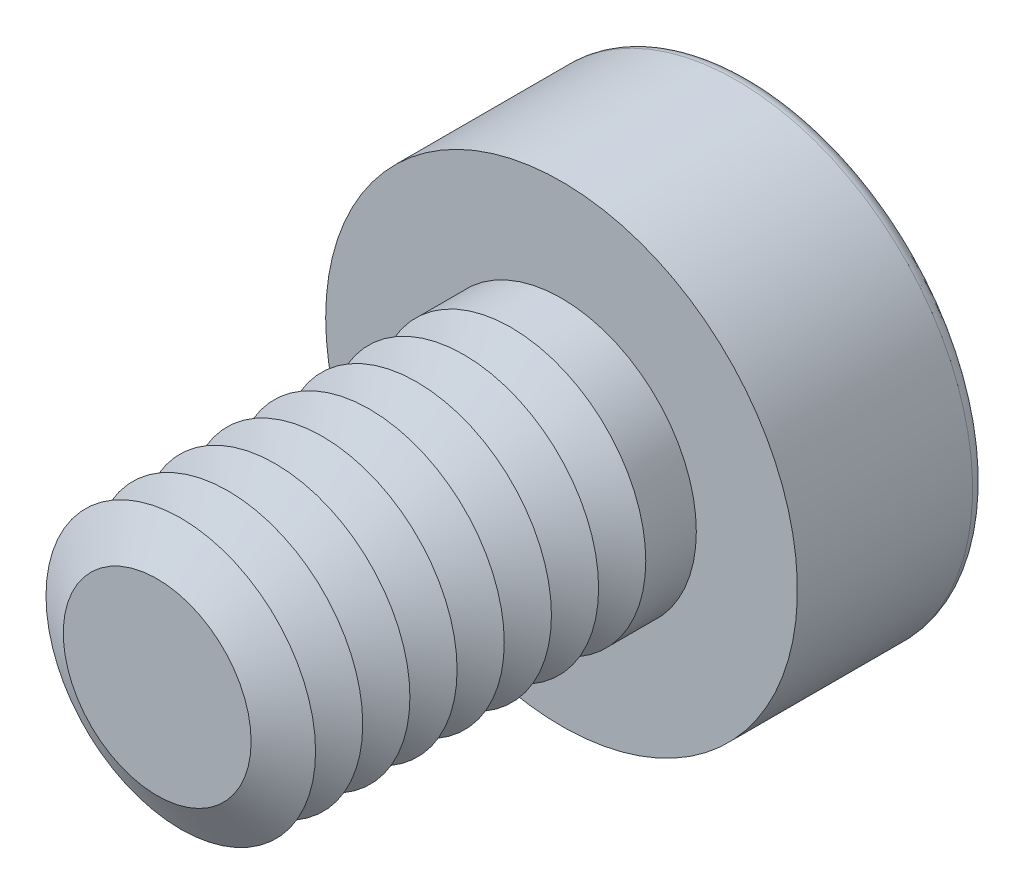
SolidWorks part; units mm, degrees
ref_plane "Front Plane" through (0, 0, 0) normal (0, 0, 1) x (1, 0, 0)
ref_plane "Top Plane" through (0, 0, 0) normal (0, 1, 0) x (1, 0, 0)
ref_plane "Right Plane" through (0, 0, 0) normal (1, 0, 0) x (0, 0, -1)
sketch "Sketch1" plane through (0, 0, 0) normal (0, 0, 1) x (1, 0, 0)
  circle A0 centre (0, 0) radius 2
  dimension "D1" = 4
extrude "Boss-Extrude1" add sketch "Sketch1" along normal blind 6
sketch "Sketch2" plane through (0, 0, 0) normal (0, 0, -1) x (-1, 0, 0)
  circle A0 centre (0, 0) radius 3.5
  dimension "D1" = 7
extrude "Boss-Extrude2" add sketch "Sketch2" along normal blind 2.8
sketch "Sketch3" plane through (0, 0, -2.8) normal (0, 0, -1) x (-1, 0, 0)
  line L1 (-0.7217, 1.25) -> (-1.4434, 0)
  line L2 (-1.4434, 0) -> (-0.7217, -1.25)
  line L3 (-0.7217, -1.25) -> (0.7217, -1.25)
  line L4 (0.7217, -1.25) -> (1.4434, 0)
  line L5 (1.4434, 0) -> (0.7217, 1.25)
  line L6 (0.7217, 1.25) -> (-0.7217, 1.25)
  circle A0 centre (0, 0) radius 1.25 construction
  dimension "D1" = 2.5
extrude "Cut-Extrude1" cut sketch "Sketch3" against normal blind 1.875
fillet "Fillet1" radius 0.2 1 edges at (-3.5, 0, -2.8)
sketch "Sketch4" plane through (0, 0, -0.925) normal (0, 0, -1) x (-1, 0, 0)
  line L0 (0.7217, -1.25) -> (1.4434, 0) construction
  circle A0 centre (0, 0) radius 1.25
extrude "Cut-Extrude2" cut sketch "Sketch4" against normal through all draft 60
sketch "Sketch5" plane through (0, 0, -2.8) normal (0, 0, -1) x (-1, 0, 0)
  circle A0 centre (0, 0) radius 1.4434
extrude "Cut-Extrude3" cut sketch "Sketch5" against normal through all draft 75
sketch "Sketch7" plane through (0, 0, 0) normal (1, 0, 0) x (0, 0, -1)
  line L25 (-6, 1.3938) -> (-5.65, 2)
  line L26 (-6, 2) -> (-6, -2) construction
  line L27 (-5.65, 2) -> (-6.35, 2)
  line L28 (-6.35, 2) -> (-6, 1.3938)
  line L29 (0, 2) -> (-6, 2) construction
  dimension "D1" = 0.7
revolve "Cut-Revolve1" cut sketch "Sketch7" angle 360 about axis through (0, 0, 6) along (0, 0, -1)
pattern_linear "LPattern1" count 8 spacing 0.7 along (0, 0, -1) of "Cut-Revolve1"
